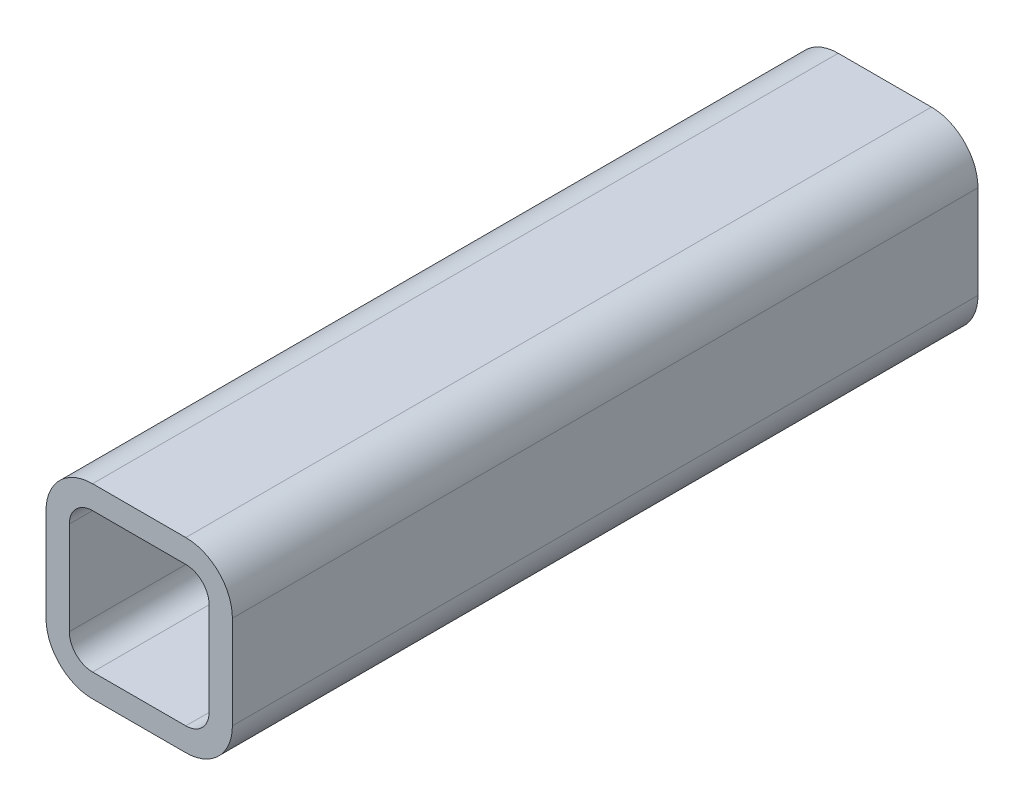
SolidWorks part; units mm, degrees
ref_plane "Front Plane" through (0, 0, 0) normal (0, 0, 1) x (1, 0, 0)
ref_plane "Top Plane" through (0, 0, 0) normal (0, 1, 0) x (1, 0, 0)
ref_plane "Right Plane" through (0, 0, 0) normal (1, 0, 0) x (0, 0, -1)
sketch "Sketch1" plane through (0, 0, 0) normal (0, 0, 1) x (1, 0, 0)
sketch_block_instance "HSS3x3x0.375-1"
sketch_block "HSS3x3x0.375"
extrude "Boss-Extrude1" add sketch "Sketch1" along normal blind 304.8
